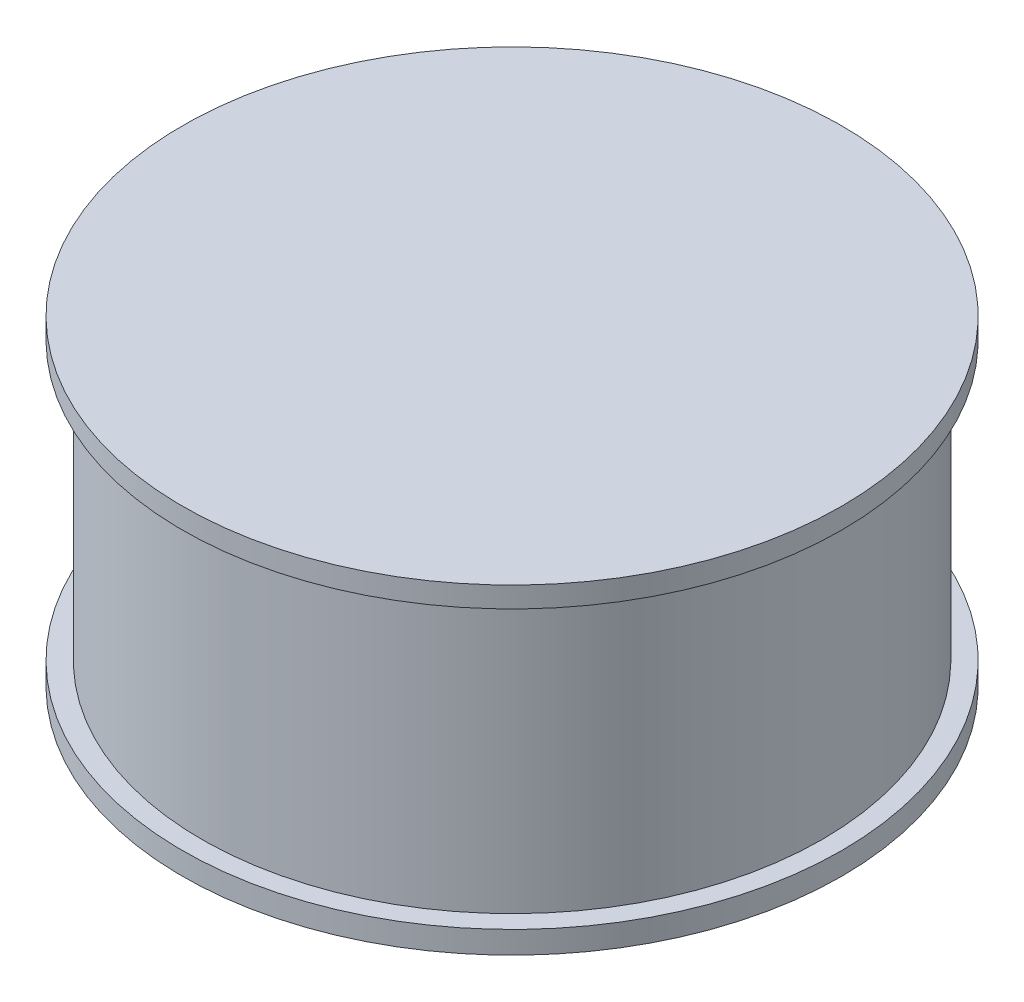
SolidWorks part; units mm, degrees
ref_plane "Face" through (0, 0, 0) normal (0, 0, 1) x (1, 0, 0)
ref_plane "Dessus" through (0, 0, 0) normal (0, 1, 0) x (1, 0, 0)
ref_plane "Droite" through (0, 0, 0) normal (1, 0, 0) x (0, 0, -1)
sketch "Esquisse1" plane through (0, 0, 0) normal (0, 0, 1) x (1, 0, 0)
  line L0 (-8, 58.0194) -> (-34.6999, 58.0194)
  line L1 (-8, 83.5) -> (-8, 57.5) construction
  line L2 (-34.6999, 58.0194) -> (-34.6999, 60.3683)
  line L3 (-34.6999, 91.7696) -> (0, 91.7696)
  line L4 (0, 91.7696) -> (0, 85.9186)
  line L5 (0, 0.5) -> (0, 12.5) construction
  line L6 (0, 85.9186) -> (-8, 85.9186)
  line L7 (-8, 58.0194) -> (-8, 85.9186)
  line L8 (0, 59.0694) -> (0, 118.4675) construction
  line L9 (-34.6999, 89.5889) -> (-32.6646, 89.5889)
  line L10 (-32.6646, 89.5889) -> (-32.6646, 60.3683)
  line L11 (-32.6646, 60.3683) -> (-34.6999, 60.3683)
  line L12 (-34.6999, 89.5889) -> (-34.6999, 91.7696)
revolve "Base-Révolution" add sketch "Esquisse1" angle 360 about L8
